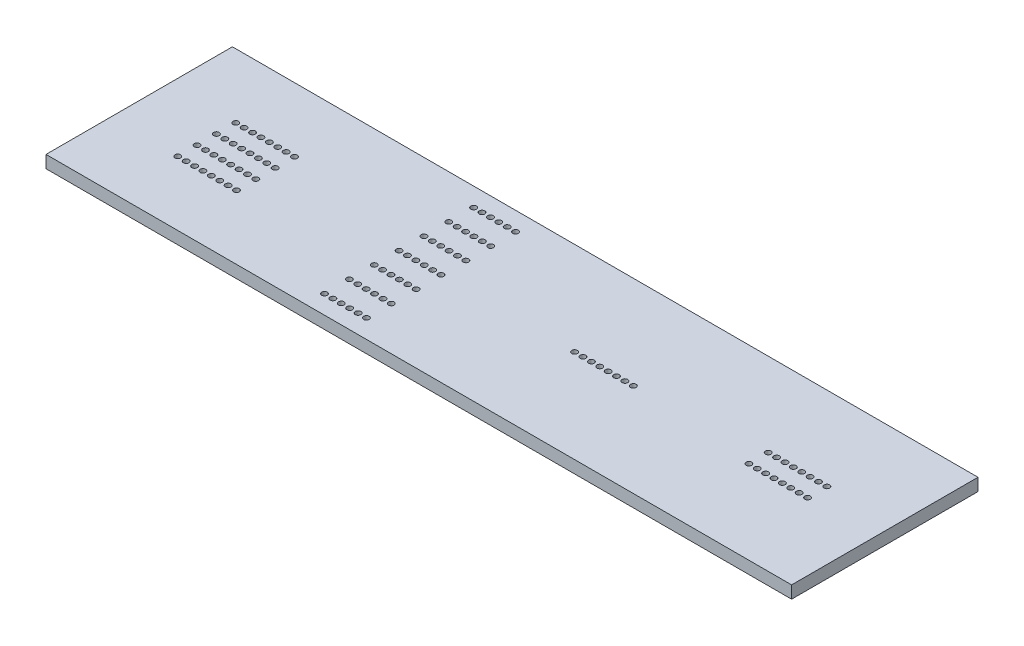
SolidWorks part; units mm, degrees
ref_plane "Plan de face" through (0, 0, 0) normal (0, 0, 1) x (1, 0, 0)
ref_plane "Plan de dessus" through (0, 0, 0) normal (0, 1, 0) x (1, 0, 0)
ref_plane "Plan de droite" through (0, 0, 0) normal (1, 0, 0) x (0, 0, -1)
sketch "Esquisse2" plane through (0, 0, 0) normal (0, 1, 0) x (1, 0, 0)
  line L1 (-60, -15) -> (60, -15)
  line L2 (-60, -15) -> (-60, 15)
  line L3 (-60, 15) -> (60, 15)
  line L4 (60, -15) -> (60, 15)
  line L5 (-60, -15) -> (60, 15) construction
  line L6 (-60, 15) -> (60, -15) construction
  point P0 (0, 0)
  dimension "D1" = 30
  dimension "D2" = 120
extrude "Boss.-Extru.1" add sketch "Esquisse2" along normal blind 2 contours L3 L4 L1 L2
sketch "Cavités" plane through (0, 0, 0) normal (0, 1, 0) x (1, 0, 0)
  line L0 (-60, -15) -> (60, -15) construction
  line L1 (-58.4, 15) -> (-30.4, 15) construction
  line L2 (-58.4, 15) -> (-58.4, -15) construction
  line L3 (-58.4, -15) -> (-30.4, -15) construction
  line L4 (-30.4, 15) -> (-30.4, -15) construction
  line L5 (-60, 15) -> (60, 15) construction
  line L6 (-28.8, 15) -> (-0.8, 15) construction
  line L7 (-28.8, 15) -> (-28.8, -15) construction
  line L8 (-28.8, -15) -> (-0.8, -15) construction
  line L9 (-0.8, 15) -> (-0.8, -15) construction
  line L10 (-30.4, 15) -> (-28.8, 15) construction
  line L11 (0.8, 15) -> (28.8, 15) construction
  line L12 (0.8, 15) -> (0.8, -15) construction
  line L13 (0.8, -15) -> (28.8, -15) construction
  line L14 (28.8, 15) -> (28.8, -15) construction
  line L15 (30.4, 15) -> (58.4, 15) construction
  line L16 (30.4, 15) -> (30.4, -15) construction
  line L17 (30.4, -15) -> (58.4, -15) construction
  line L18 (58.4, 15) -> (58.4, -15) construction
  line L19 (-0.8, 15) -> (0.8, 15) construction
  line L20 (28.8, 15) -> (30.4, 15) construction
  line L21 (-60, 15) -> (-58.4, 15) construction
  line L22 (58.4, 15) -> (60, 15) construction
  dimension "D1" = 28
  dimension "D2" = 1.6
sketch "Esquisse7" plane through (0, 2, 0) normal (0, 1, 0) x (1, 0, 0)
  line L0 (-58.4, 0) -> (-49.125, 0) construction
  line L1 (-49.125, 4.6665) -> (-39.675, 4.6665) construction
  line L2 (-49.125, 4.6665) -> (-49.125, -4.6665) construction
  line L3 (-49.125, -4.6665) -> (-39.675, -4.6665) construction
  line L4 (-39.675, 4.6665) -> (-39.675, -4.6665) construction
  line L5 (-58.4, 15) -> (-58.4, -15) construction
  line L6 (-39.675, 0) -> (-30.4, 0) construction
  line L7 (-30.4, 15) -> (-30.4, -15) construction
  dimension "D1" = 9.45
  dimension "D2" = 9.333
sketch "Esquisse8" plane through (0, 2, 0) normal (0, 1, 0) x (1, 0, 0)
  circle A0 centre (-49.125, 4.6665) radius 0.45
  dimension "D1" = 0.9
extrude "Enlèv. mat.-Extru.3" cut sketch "Esquisse8" against normal up to next
pattern_linear "Répétition linéaire4" count 8 spacing 1.35 along (1, 0, 0) count 4 spacing 3.111 along (0, 0, 1) of "Enlèv. mat.-Extru.3"
sketch "Esquisse9" plane through (0, 2, 0) normal (0, 1, 0) x (1, 0, 0)
  line L0 (-28.8, 0) -> (-18.175, 0) construction
  line L1 (-18.175, 12) -> (-11.425, 12) construction
  line L2 (-18.175, 12) -> (-18.175, -12) construction
  line L3 (-18.175, -12) -> (-11.425, -12) construction
  line L4 (-11.425, 12) -> (-11.425, -12) construction
  line L5 (-28.8, 15) -> (-28.8, -15) construction
  line L6 (-11.425, 0) -> (-0.8, 0) construction
  line L7 (-0.8, 15) -> (-0.8, -15) construction
  dimension "D1" = 6.75
  dimension "D2" = 24
sketch "Esquisse10" plane through (0, 2, 0) normal (0, 1, 0) x (1, 0, 0)
  circle A0 centre (-18.175, 12) radius 0.45
  dimension "D1" = 0.9
extrude "Enlèv. mat.-Extru.4" cut sketch "Esquisse10" against normal up to next
pattern_linear "Répétition linéaire5" count 6 spacing 1.35 along (1, 0, 0) count 7 spacing 4 along (0, 0, 1) of "Enlèv. mat.-Extru.4"
sketch "Esquisse11" plane through (0, 2, 0) normal (0, 1, 0) x (1, 0, 0)
  line L0 (0.8, 0) -> (10.075, 0) construction
  line L5 (0.8, 15) -> (0.8, -15) construction
  line L6 (19.525, 0) -> (28.8, 0) construction
  line L7 (28.8, 15) -> (28.8, -15) construction
  line L8 (10.075, 0) -> (19.525, 0) construction
  dimension "D1" = 9.45
sketch "Esquisse12" plane through (0, 2, 0) normal (0, 1, 0) x (1, 0, 0)
  circle A0 centre (10.075, 0) radius 0.45
  point P3 (0, 0)
  point P4 (11.275, 0)
  dimension "D1" = 0.9
extrude "Enlèv. mat.-Extru.5" cut sketch "Esquisse12" against normal up to next
pattern_linear "Répétition linéaire6" count 8 spacing 1.35 along (1, 0, 0) of "Enlèv. mat.-Extru.5"
sketch "Esquisse13" plane through (0, 2, 0) normal (0, 1, 0) x (1, 0, 0)
  line L0 (30.4, 0) -> (39.675, 0) construction
  line L1 (39.675, 1.555) -> (49.125, 1.555) construction
  line L2 (39.675, 1.555) -> (39.675, -1.555) construction
  line L3 (39.675, -1.555) -> (49.125, -1.555) construction
  line L4 (49.125, 1.555) -> (49.125, -1.555) construction
  line L5 (30.4, 15) -> (30.4, -15) construction
  line L6 (49.125, 0) -> (58.4, 0) construction
  line L7 (58.4, 15) -> (58.4, -15) construction
  dimension "D1" = 3.11
  dimension "D2" = 9.45
sketch "Esquisse14" plane through (0, 2, 0) normal (0, 1, 0) x (1, 0, 0)
  circle A0 centre (39.675, 1.555) radius 0.45
  dimension "D1" = 0.9
extrude "Enlèv. mat.-Extru.6" cut sketch "Esquisse14" against normal up to next
pattern_linear "Répétition linéaire7" count 8 spacing 1.35 along (1, 0, 0) count 2 spacing 3.11 along (0, 0, 1) of "Enlèv. mat.-Extru.6"
